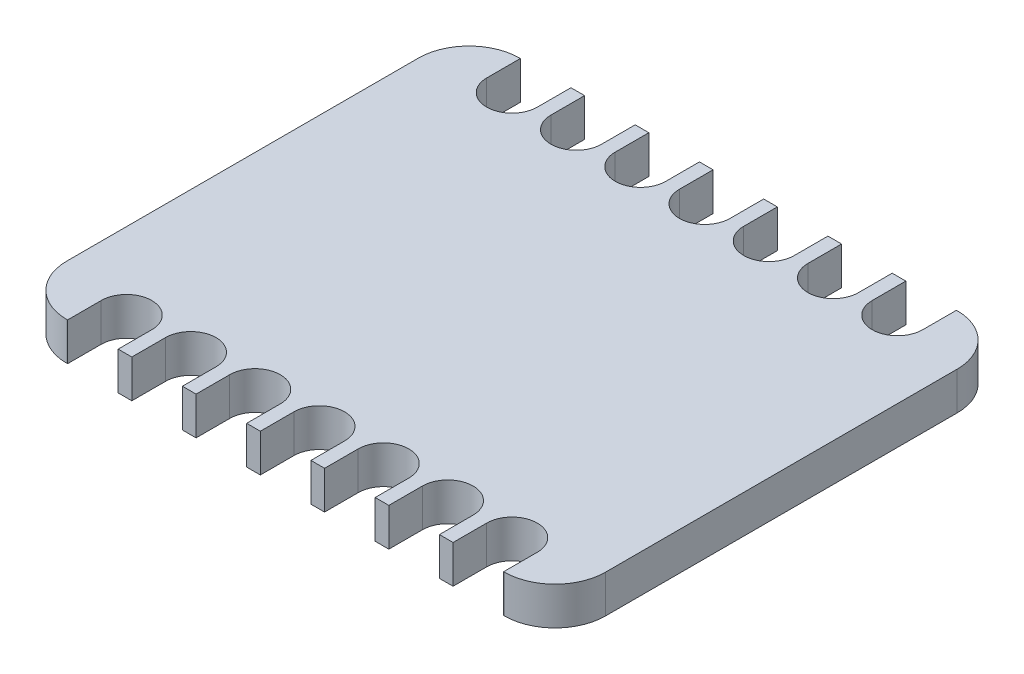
SolidWorks part; units mm, degrees
ref_plane "Front Plane" through (0, 0, 0) normal (0, 0, 1) x (1, 0, 0)
ref_plane "Top Plane" through (0, 0, 0) normal (0, 1, 0) x (1, 0, 0)
ref_plane "Right Plane" through (0, 0, 0) normal (1, 0, 0) x (0, 0, -1)
sketch "Sketch1" plane through (0, 0, 0) normal (0, 1, 0) x (1, 0, 0)
  line L92 (-10.65, 6.95) -> (-10.65, -6.95)
  line L93 (-8.65, -8.95) -> (-8.62, -8.95)
  line L94 (-8.62, -8.95) -> (-8.62, -7.62)
  line L95 (-6.62, -7.62) -> (-6.62, -8.95)
  line L96 (-6.62, -8.95) -> (-6.08, -8.95)
  line L97 (-6.08, -8.95) -> (-6.08, -7.62)
  line L98 (-4.08, -7.62) -> (-4.08, -8.95)
  line L99 (-4.08, -8.95) -> (-3.54, -8.95)
  line L100 (-3.54, -8.95) -> (-3.54, -7.62)
  line L101 (-1.54, -7.62) -> (-1.54, -8.95)
  line L102 (-1.54, -8.95) -> (-1, -8.95)
  line L103 (-1, -8.95) -> (-1, -7.62)
  line L104 (1, -7.62) -> (1, -8.95)
  line L105 (1, -8.95) -> (1.54, -8.95)
  line L106 (1.54, -8.95) -> (1.54, -7.62)
  line L107 (3.54, -7.62) -> (3.54, -8.95)
  line L108 (3.54, -8.95) -> (4.08, -8.95)
  line L109 (4.08, -8.95) -> (4.08, -7.62)
  line L110 (6.08, -7.62) -> (6.08, -8.95)
  line L111 (6.08, -8.95) -> (6.62, -8.95)
  line L112 (6.62, -8.95) -> (6.62, -7.62)
  line L113 (8.62, -7.62) -> (8.62, -8.95)
  line L114 (8.62, -8.95) -> (8.65, -8.95)
  line L115 (10.65, -6.95) -> (10.65, 6.95)
  line L116 (8.65, 8.95) -> (8.62, 8.95)
  line L117 (8.62, 8.95) -> (8.62, 7.62)
  line L118 (6.62, 7.62) -> (6.62, 8.95)
  line L119 (6.62, 8.95) -> (6.08, 8.95)
  line L120 (6.08, 8.95) -> (6.08, 7.62)
  line L121 (4.08, 7.62) -> (4.08, 8.95)
  line L122 (4.08, 8.95) -> (3.54, 8.95)
  line L123 (3.54, 8.95) -> (3.54, 7.62)
  line L124 (1.54, 7.62) -> (1.54, 8.95)
  line L125 (1.54, 8.95) -> (1, 8.95)
  line L126 (1, 8.95) -> (1, 7.62)
  line L127 (-1, 7.62) -> (-1, 8.95)
  line L128 (-1, 8.95) -> (-1.54, 8.95)
  line L129 (-1.54, 8.95) -> (-1.54, 7.62)
  line L130 (-3.54, 7.62) -> (-3.54, 8.95)
  line L131 (-3.54, 8.95) -> (-4.08, 8.95)
  line L132 (-4.08, 8.95) -> (-4.08, 7.62)
  line L133 (-6.08, 7.62) -> (-6.08, 8.95)
  line L134 (-6.08, 8.95) -> (-6.62, 8.95)
  line L135 (-6.62, 8.95) -> (-6.62, 7.62)
  line L136 (-8.62, 7.62) -> (-8.62, 8.95)
  line L137 (-8.62, 8.95) -> (-8.65, 8.95)
  arc A36 (-8.65, 8.95) -> (-10.65, 6.95) centre (-8.65, 6.95) ccw
  arc A37 (-10.65, -6.95) -> (-8.65, -8.95) centre (-8.65, -6.95) ccw
  arc A38 (-6.62, -7.62) -> (-8.62, -7.62) centre (-7.62, -7.62) ccw
  arc A39 (-4.08, -7.62) -> (-6.08, -7.62) centre (-5.08, -7.62) ccw
  arc A40 (-1.54, -7.62) -> (-3.54, -7.62) centre (-2.54, -7.62) ccw
  arc A41 (1, -7.62) -> (-1, -7.62) centre (0, -7.62) ccw
  arc A42 (3.54, -7.62) -> (1.54, -7.62) centre (2.54, -7.62) ccw
  arc A43 (6.08, -7.62) -> (4.08, -7.62) centre (5.08, -7.62) ccw
  arc A44 (8.62, -7.62) -> (6.62, -7.62) centre (7.62, -7.62) ccw
  arc A45 (8.65, -8.95) -> (10.65, -6.95) centre (8.65, -6.95) ccw
  arc A46 (10.65, 6.95) -> (8.65, 8.95) centre (8.65, 6.95) ccw
  arc A47 (6.62, 7.62) -> (8.62, 7.62) centre (7.62, 7.62) ccw
  arc A48 (4.08, 7.62) -> (6.08, 7.62) centre (5.08, 7.62) ccw
  arc A49 (1.54, 7.62) -> (3.54, 7.62) centre (2.54, 7.62) ccw
  arc A50 (-1, 7.62) -> (1, 7.62) centre (0, 7.62) ccw
  arc A51 (-3.54, 7.62) -> (-1.54, 7.62) centre (-2.54, 7.62) ccw
  arc A52 (-6.08, 7.62) -> (-4.08, 7.62) centre (-5.08, 7.62) ccw
  arc A53 (-8.62, 7.62) -> (-6.62, 7.62) centre (-7.62, 7.62) ccw
extrude "Boss-Extrude1" add sketch "Sketch1" along normal blind 1.5
